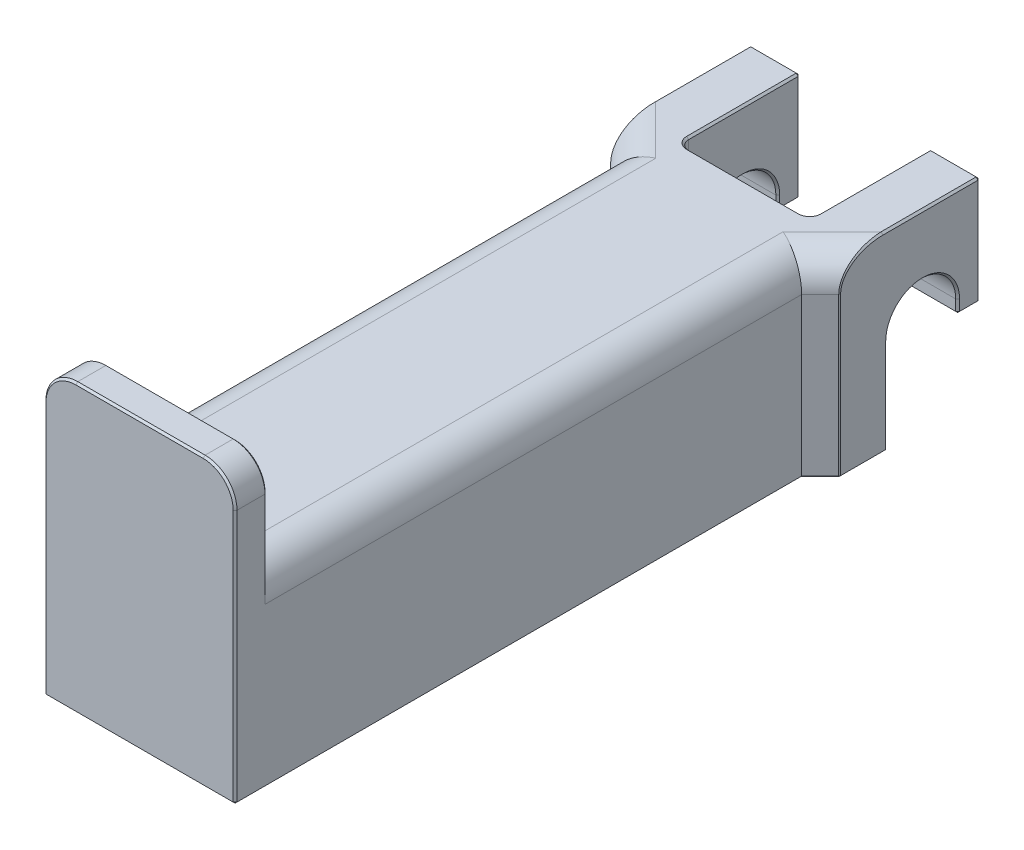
SolidWorks part; units mm, degrees
ref_plane "Ebene vorne" through (0, 0, 0) normal (0, 0, 1) x (1, 0, 0)
ref_plane "Ebene oben" through (0, 0, 0) normal (0, 1, 0) x (1, 0, 0)
ref_plane "Ebene rechts" through (0, 0, 0) normal (1, 0, 0) x (0, 0, -1)
sketch "Skizze1" plane through (0, 0, 0) normal (0, 0, 1) x (1, 0, 0)
  line L1 (-15, -15) -> (15, -15)
  line L2 (-15, -15) -> (-15, 15)
  line L3 (-15, 15) -> (15, 15)
  line L4 (15, -15) -> (15, 15)
  line L5 (-15, -15) -> (15, 15) construction
  line L6 (-15, 15) -> (15, -15) construction
  point P0 (0, 0)
  dimension "D1" = 30
  dimension "D2" = 30
extrude "Aufsatz-Linear austragen1" add sketch "Skizze1" along normal blind 90
sketch "Skizze5" plane through (0, 0, 0) normal (0, 0, -1) x (-1, 0, 0)
  line L0 (15, -15) -> (-15, -15) construction
  line L1 (-15, 15) -> (-10.25, 15)
  line L2 (-15, 15) -> (-15, -15)
  line L3 (-15, -15) -> (-10.25, -15)
  line L4 (-10.25, 15) -> (-10.25, -15)
  line L5 (-15, 15) -> (15, 15) construction
  line L6 (15, -15) -> (10.25, -15)
  line L7 (15, -15) -> (15, 15)
  line L8 (15, 15) -> (10.25, 15)
  line L9 (10.25, -15) -> (10.25, 15)
  dimension "D1" = 20.5
extrude "Aufsatz-Linear austragen3" add sketch "Skizze5" along normal blind 19
sketch "Skizze6" plane through (-15, 0, 0) normal (-1, 0, 0) x (0, 0, 1)
  line L0 (-15.5, -15) -> (-15.5, 0)
  line L1 (90, -15) -> (-19, -15) construction
  line L2 (-4.5, 0) -> (-4.5, -15)
  line L3 (-4.5, -15) -> (-15.5, -15)
  line L4 (-19, -15) -> (-19, 15) construction
  arc A0 (-15.5, 0) -> (-4.5, 0) centre (-10, 0) cw
  dimension "D1" = 11
  dimension "D2" = 9
  dimension "D3" = 15
extrude "Schnitt-Linear austragen1" cut sketch "Skizze6" against normal through all
sketch "Skizze7" plane through (-15, 0, 0) normal (-1, 0, 0) x (0, 0, 1)
  line L0 (-15.5, 0) -> (-15.5, -15) construction
  line L1 (-15.5, -2) -> (-19, -2)
  line L2 (-15.5, -2) -> (-15.5, -15)
  line L3 (-15.5, -15) -> (-19, -15)
  line L4 (-19, -2) -> (-19, -15)
  dimension "D1" = 2
extrude "Schnitt-Linear austragen2" cut sketch "Skizze7" against normal through all
sketch "Skizze8" plane through (-15, 0, 0) normal (-1, 0, 0) x (0, 0, 1)
  line L0 (3, -15) -> (3, 15)
  line L7 (-19, 15) -> (-19, -2)
  line L8 (-19, -2) -> (-15.5, -2)
  line L9 (-15.5, -2) -> (-15.5, 0)
  line L10 (-4.5, 0) -> (-4.5, -15)
  line L11 (-4.5, -15) -> (90, -15)
  line L12 (90, -15) -> (90, 15)
  line L13 (90, 15) -> (-19, 15)
  line L14 (-19, 15) -> (-19, -2)
  line L15 (-19, -2) -> (-15.5, -2)
  line L16 (-15.5, -2) -> (-15.5, 0)
  line L17 (-4.5, 0) -> (-4.5, -15)
  line L18 (-4.5, -15) -> (3, -15)
  line L20 (3, 15) -> (-19, 15)
  arc A1 (-4.5, 0) -> (-15.5, 0) centre (-10, 0) ccw
  arc A2 (-4.5, 0) -> (-15.5, 0) centre (-10, 0) ccw
  dimension "D2" = 22
  dimension "D1" = 0
extrude "Aufsatz-Linear austragen4" add sketch "Skizze8" along normal blind 3
sketch "Skizze9" plane through (15, 0, 0) normal (1, 0, 0) x (0, 0, -1)
  line L0 (-3, -15) -> (-3, 15)
  line L1 (-90, -15) -> (4.5, -15) construction
  line L7 (15.5, 0) -> (15.5, -2)
  line L8 (15.5, 0) -> (15.5, -2)
  line L9 (15.5, -2) -> (19, -2)
  line L10 (19, 15) -> (-90, 15)
  line L12 (-90, -15) -> (4.5, -15)
  line L13 (15.5, -2) -> (19, -2)
  line L17 (19, 15) -> (-3, 15)
  line L19 (-3, -15) -> (4.5, -15)
  line L21 (19, -2) -> (19, 15)
  line L22 (19, -2) -> (19, 15)
  line L23 (-90, 15) -> (-90, -15)
  line L24 (4.5, -15) -> (4.5, 0)
  line L26 (4.5, -15) -> (4.5, 0)
  arc A1 (15.5, 0) -> (4.5, 0) centre (10, 0) ccw
  arc A3 (15.5, 0) -> (4.5, 0) centre (10, 0) ccw
  point P8 (-0.8692, -15)
  dimension "D2" = 22
  dimension "D1" = 0
extrude "Aufsatz-Linear austragen5" add sketch "Skizze9" along normal blind 3
chamfer "Fase3" distance 3 angle 45 2 edges at (-15, 0, 3) (15, 0, 3)
fillet "Verrundung1" radius 5 4 edges at (15, 15, 48) (-15, 15, 48) (16.5, 15, 4.5) (-16.5, 15, 4.5)
sketch "Skizze4" plane through (0, 0, 90) normal (0, 0, 1) x (1, 0, 0)
  line L0 (-15, -15) -> (-15, 25)
  line L1 (-10, 30) -> (10, 30)
  line L2 (15, 25) -> (15, -15)
  line L3 (15, -15) -> (-15, -15)
  line L4 (10, 15) -> (-10, 15) construction
  arc A0 (-15, 25) -> (-10, 30) centre (-10, 25) cw
  arc A1 (10, 30) -> (15, 25) centre (10, 25) cw
  arc A2 (15, 10) -> (10, 15) centre (10, 10) ccw construction
  dimension "D1" = 15
extrude "Aufsatz-Linear austragen2" add sketch "Skizze4" along normal blind 5
fillet "Verrundung2" radius 1.5 2 edges at (10.25, 0, 0) (-10.25, 0, 0)
chamfer "Fase1" distance 0.3 angle 45 63 edges at (-18, 6.5, -19) (-18, -2, -17.25) (-18, -1, -15.5) (-18, 5.5, -10) (-18, -7.5, -4.5) (-18, -15, -0.75) (-18, -2.5, 3) (18, 5.5, -10) (18, -1, -15.5) (18, -2, -17.25) (18, 6.5, -19) (18, 15, -11.5355) (18, -15, -0.75) (18, -7.5, -4.5) (-16.5, -15, 4.5) (16.5, -15, 4.5) (-18, 15, -11.5355) (10.25, 15, -10.25) (-14, 15, -0.0711) (18, -2.5, 3) (18, 13.5355, 0.9289) (16.5, 10, 4.5) (-18, 13.5355, 0.9289) (14.125, 15, -19) (15, 17.5, 90) (13.5355, 28.5355, 90) (0, 30, 90) (-13.5355, 28.5355, 90) (-15, 17.5, 90) (0, -15, 95) (15, 5, 95) (13.5355, 28.5355, 95) (0, 30, 95) (-13.5355, 28.5355, 95) (-15, 5, 95) (0, -15, 0) (0, 15, 0) (9.8107, 15, -0.4393) (9.8107, -15, -0.4393) (-9.8107, -15, -0.4393) (-9.8107, 15, -0.4393) (-10.25, 15, -10.25) (-14.125, 15, -19) (-10.25, 6.5, -19) (-10.25, -15, -3) (-10.25, -7.5, -4.5) (-10.25, 5.5, -10) (-10.25, -1, -15.5) (10.25, -15, -3) (14.125, -15, -4.5) (-14.125, -15, -4.5) (10.25, 5.5, -10) (10.25, -7.5, -4.5) (10.25, -1, -15.5) (10.25, 6.5, -19) (14.125, -2, -15.5) (-14.125, -2, -15.5) (14.125, -2, -19) (10.25, -2, -17.25) (-10.25, -2, -17.25) (-14.125, -2, -19) (15, -15, 50.5) (-15, -15, 50.5)
